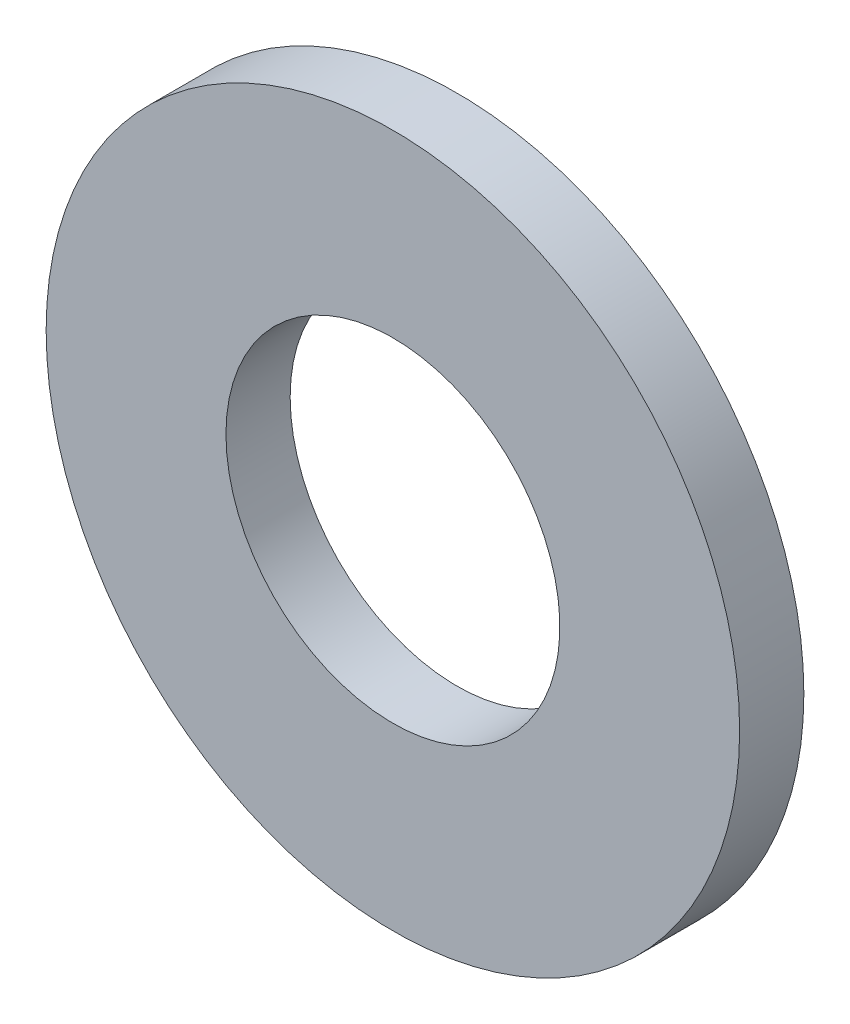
SolidWorks part; units mm, degrees
ref_plane "Plan1" through (0, 0, 0) normal (0, 0, 1) x (1, 0, 0)
ref_plane "Plan2" through (0, 0, 0) normal (0, 1, 0) x (1, 0, 0)
ref_plane "Plan3" through (0, 0, 0) normal (1, 0, 0) x (0, 0, -1)
extrude "Corps" add sketch "E_corps" along normal blind 2.5
sketch "E_corps" plane through (0, 0, 0) normal (0, 0, 1) x (1, 0, 0)
  circle A0 centre (0, 0) radius 13.5
  dimension "Diam_base" = 27
extrude "Diamètre_nominal" cut sketch "E_perçage" against normal through all
sketch "E_perçage" plane through (0, 0, 0) normal (0, 0, -1) x (-1, 0, 0)
  circle A0 centre (0, 0) radius 6.5
  dimension "Diamètre_nominal" = 13
